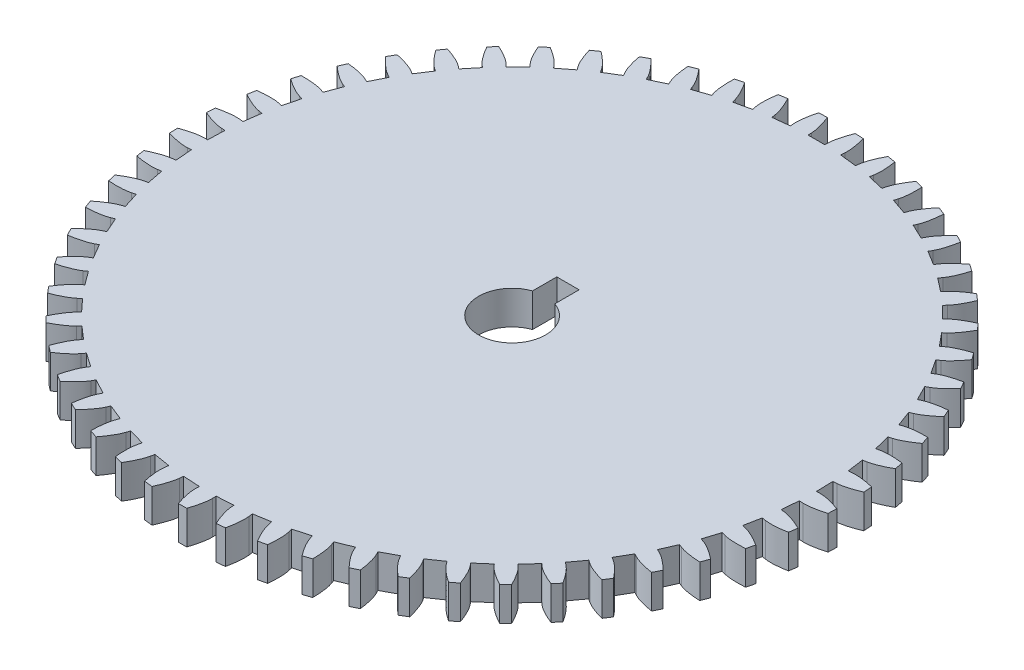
SolidWorks part; units mm, degrees
ref_plane "Front Plane" through (0, 0, 0) normal (0, 0, 1) x (1, 0, 0)
ref_plane "Top Plane" through (0, 0, 0) normal (0, 1, 0) x (1, 0, 0)
ref_plane "Right Plane" through (0, 0, 0) normal (1, 0, 0) x (0, 0, -1)
sketch "Sketch1" plane through (0, 0, 0) normal (0, 1, 0) x (1, 0, 0)
  line L0 (0, 0) -> (0, 13.7961) construction
  line L1 (0, 0) -> (-13.7961, 0) construction
  line L2 (0, 0) -> (-14.7444, -0.4064) construction
  line L3 (0, 0) -> (-13.7752, -0.76) construction
  line L4 (0, 0) -> (-13.7124, -1.5177) construction
  circle A0 centre (0, 0) radius 14.25 construction
  circle A1 centre (0, 0) radius 13.7961 construction
  circle A2 centre (0, 0) radius 13.625 construction
  circle A3 centre (0, 0) radius 14.75 construction
  spline S0 degree 4 poles (-13.7961, 0) (-13.82, 0) (-13.8868, -0.0025) (-14.0127, -0.0168) (-14.2161, -0.0538) (-14.4715, -0.1208) (-14.7955, -0.2298) (-15.1676, -0.3863) (-15.5644, -0.5872) (-15.9812, -0.8357) (-16.3823, -1.1095) (-16.7674, -1.4054) (-17.1366, -1.7208) (-17.5655, -2.1249) (-18.0534, -2.6418) (-18.582, -3.285) (-19.1302, -4.0656) (-19.6297, -4.8991) (-20.0717, -5.7639) (-20.4095, -6.5443) (-20.6648, -7.2257) (-20.8552, -7.803) (-20.9943, -8.2661) (-21.1519, -8.8561) (-21.2878, -9.4404) (-21.4031, -10.0472) (-21.5158, -10.7499) (-21.5908, -11.3826) (-21.6431, -11.9343) (-21.6852, -12.7113) (-21.6956, -13.1111) (-21.7009, -13.7341) (-21.6896, -14.0181) (-21.6847, -14.2699) (-21.68, -14.3453) (-21.678, -14.3998) (-21.677, -14.4291) knots 0 0 0 0 0 0.005377 0.015084 0.028532 0.04661 0.064855 0.092111 0.119476 0.146842 0.174209 0.201575 0.228941 0.256307 0.307035 0.361767 0.4165 0.471232 0.525964 0.580697 0.608063 0.635429 0.662795 0.690161 0.744894 0.77226 0.799626 0.854358 0.881725 0.909091 0.954545 0.977273 0.988636 0.994318 1 1 1 1 1 construction
  spline S1 degree 4 poles (-13.7961, 0) (-13.82, 0) (-13.8868, -0.0025) (-14.0127, -0.0168) (-14.2161, -0.0538) (-14.4715, -0.1208) (-14.7955, -0.2298) (-15.1676, -0.3863) (-15.5644, -0.5872) (-15.9812, -0.8357) (-16.3823, -1.1095) (-16.7674, -1.4054) (-17.1366, -1.7208) (-17.5655, -2.1249) (-18.0534, -2.6418) (-18.582, -3.285) (-19.1302, -4.0656) (-19.6297, -4.8991) (-20.0717, -5.7639) (-20.4095, -6.5443) (-20.6648, -7.2257) (-20.8552, -7.803) (-20.9943, -8.2661) (-21.1519, -8.8561) (-21.2878, -9.4404) (-21.4031, -10.0472) (-21.5158, -10.7499) (-21.5908, -11.3826) (-21.6431, -11.9343) (-21.6729, -12.4833) (-21.6821, -12.7051) (-21.6858, -12.8154) knots 0 0 0 0 0 0.005377 0.015084 0.028532 0.04661 0.064855 0.092111 0.119476 0.146842 0.174209 0.201575 0.228941 0.256307 0.307035 0.361767 0.4165 0.471232 0.525964 0.580697 0.608063 0.635429 0.662795 0.690161 0.744894 0.77226 0.799626 0.854358 0.881725 0.909091 0.909091 0.909091 0.909091 0.909091
  dimension "D1" = 29.5
  dimension "D2" = 28.5
  dimension "D3" = 27.5922
  dimension "D4" = 27.25
  dimension "D5" = 13.7961
  dimension "D6" = 1.579
  dimension "D7" = 3.158
  dimension "D8" = 6.316
sketch "Sketch2" plane through (0, 0, 0) normal (0, 1, 0) x (1, 0, 0)
  line L0 (0, 0) -> (-14.7444, -0.4064) construction
  line L1 (0, 0) -> (-14.7444, -0.4064) construction
  line L2 (0, 0) -> (-13.7752, -0.76) construction
  line L3 (0, 0) -> (-13.7961, 0) construction
  line L4 (0, 0) -> (-13.7124, -1.5177) construction
  line L5 (0, 0) -> (-13.7752, -0.76) construction
  line L6 (0, 0) -> (-13.7961, 0) construction
  line L7 (0, 0) -> (-13.7124, -1.5177) construction
  line L8 (-13.7752, -0.76) -> (-13.6043, -0.7506)
  line L9 (-13.6043, -0.7506) -> (-13.5423, -1.4989)
  line L10 (-13.5423, -1.4989) -> (-13.7124, -1.5177) construction
  line L11 (-13.5423, -1.4989) -> (-1.4909, -0.165)
  line L12 (-13.7961, 0) -> (-1.5, 0)
  circle A0 centre (0, 0) radius 13.625 construction
  circle A1 centre (0, 0) radius 13.7961 construction
  circle A2 centre (0, 0) radius 14.25 construction
  circle A3 centre (0, 0) radius 14.75 construction
  circle A4 centre (0, 0) radius 13.625 construction
  circle A5 centre (0, 0) radius 13.7961 construction
  circle A6 centre (0, 0) radius 14.25 construction
  circle A7 centre (0, 0) radius 14.75 construction
  arc A8 (-14.738, -0.5946) -> (-14.7484, -0.2182) centre (0, 0) cw
  circle A11 centre (0, 0) radius 1.5 construction
  arc A12 (-1.5, 0) -> (-1.4909, -0.165) centre (0, 0) ccw
  spline S0 degree 4 poles (-41.3241, -999.5754) (-10.3099, -24.6935) (-11.2108, -0.5621) (-12.7569, 0.2117) (-14.2161, -0.0538) (-14.4715, -0.1208) (-14.7955, -0.2298) (-15.1676, -0.3863) (-15.5644, -0.5872) (-15.9812, -0.8357) (-16.3823, -1.1095) (-16.7674, -1.4054) (-17.1366, -1.7208) (-17.5655, -2.1249) (-18.0534, -2.6418) (-18.582, -3.285) (-19.1302, -4.0656) (-19.6297, -4.8991) (-20.0717, -5.7639) (-20.4095, -6.5443) (-20.6648, -7.2257) (-20.8552, -7.803) (-20.9943, -8.2661) (-21.1519, -8.8561) (-21.2878, -9.4404) (-21.4031, -10.0472) (-21.5158, -10.7499) (-21.5908, -11.3826) (-21.7893, -13.476) (-21.7333, -17.6322) (-20.1746, 17.5146) (-53.8074, -1012.2419) knots -0.287698 -0.287698 -0.287698 -0.287698 -0.287698 0.005377 0.015084 0.028532 0.04661 0.064855 0.092111 0.119476 0.146842 0.174209 0.201575 0.228941 0.256307 0.307035 0.361767 0.4165 0.471232 0.525964 0.580697 0.608063 0.635429 0.662795 0.690161 0.744894 0.77226 0.799626 0.854358 0.881725 1.29146 1.29146 1.29146 1.29146 1.29146 only from (-13.7961, 0) to (-21.6858, -12.8154) construction
  spline S1 degree 4 poles (-13.7961, 0) (-13.82, 0) (-13.8868, -0.0025) (-14.0127, -0.0168) (-14.2161, -0.0538) (-14.4306, -0.11) (-14.6004, -0.1647) (-14.7122, -0.2048) (-14.7484, -0.2182) knots 0 0 0 0 0 0.005377 0.015084 0.028532 0.04661 0.05531 0.05531 0.05531 0.05531 0.05531
  spline S2 degree 4 poles (-13.7752, -0.76) (-13.799, -0.7613) (-13.8658, -0.7625) (-13.9923, -0.7552) (-14.1975, -0.7294) (-14.4147, -0.6851) (-14.5873, -0.6398) (-14.7011, -0.606) (-14.738, -0.5946) knots 0 0 0 0 0 0.005377 0.015084 0.028532 0.04661 0.05531 0.05531 0.05531 0.05531 0.05531
  point P21 (-13.6043, -0.7506)
  point P24 (-13.5423, -1.4989)
  dimension "D2" = 3
extrude "Boss-Extrude1" add sketch "Sketch2" along normal blind 1.5
pattern_circular "CirPattern1" count 57 over 360 of "Boss-Extrude1"
sketch "Sketch3" plane through (0, 1.5, 0) normal (0, 1, 0) x (1, 0, 0)
  line L1 (0.5, 0.5) -> (-0.5, 0.5)
  line L2 (0.5, 0.5) -> (0.5, 2.5)
  line L3 (0.5, 2.5) -> (-0.5, 2.5)
  line L4 (-0.5, 0.5) -> (-0.5, 2.5)
  line L5 (0.5, 0.5) -> (-0.5, 2.5) construction
  line L6 (0.5, 2.5) -> (-0.5, 0.5) construction
  circle A0 centre (0, 0) radius 1.5 construction
  point P0 (0, 1.5)
  dimension "D1" = 2
  dimension "D2" = 1
extrude "Cut-Extrude1" cut sketch "Sketch3" against normal up to surface (1.5 mm away)
equation "\"Module\"= .5"
equation "\"Number of Teeth\"= 57"
equation "\"Pressure Angle\"= 14.5deg"
equation "\"Pitch Diameter\"= \"Number of Teeth\" * \"Module\""
equation "\"Circular Pitch\"= pi * \"Module\""
equation "\"Addendum\"= \"Module\""
equation "\"Dedendum\"= 1.25 * \"Module\""
equation "\"Base Diameter\"= \"Pitch Diameter\" * cos ( \"Pressure Angle\" )"
equation "\"Base Radius\"= \"Base Diameter\" / 2"
equation "\"Width\"= 1.5"
equation "\"Outside Diameter\"= \"Pitch Diameter\" + 2 * \"Addendum\""
equation "\"D1@Sketch1\"=\"Outside Diameter\""
equation "\"D3@Sketch1\"=\"Base Diameter\""
equation "\"Root Diameter\"= \"Pitch Diameter\" - 2 * \"Dedendum\""
equation "\"D4@Sketch1\"=\"Root Diameter\""
equation "\"Tooth Angle\"= 360 / \"Number of Teeth\""
equation "\"D6@Sketch1\"=\"Tooth Angle\"/4"
equation "\"D7@Sketch1\"=\"Tooth Angle\"/2"
equation "\"D8@Sketch1\"=\"Tooth Angle\""
equation "\"D2@Sketch1\" = \"Pitch Diameter\""
equation "\"Shaft Diameter\"= 3"
equation "\"D1@CirPattern1\" = \"Number of Teeth\""
equation "\"D2@Sketch2\"= \"Shaft Diameter\""
equation "\"D1@Boss-Extrude1\" = \"Width\""
